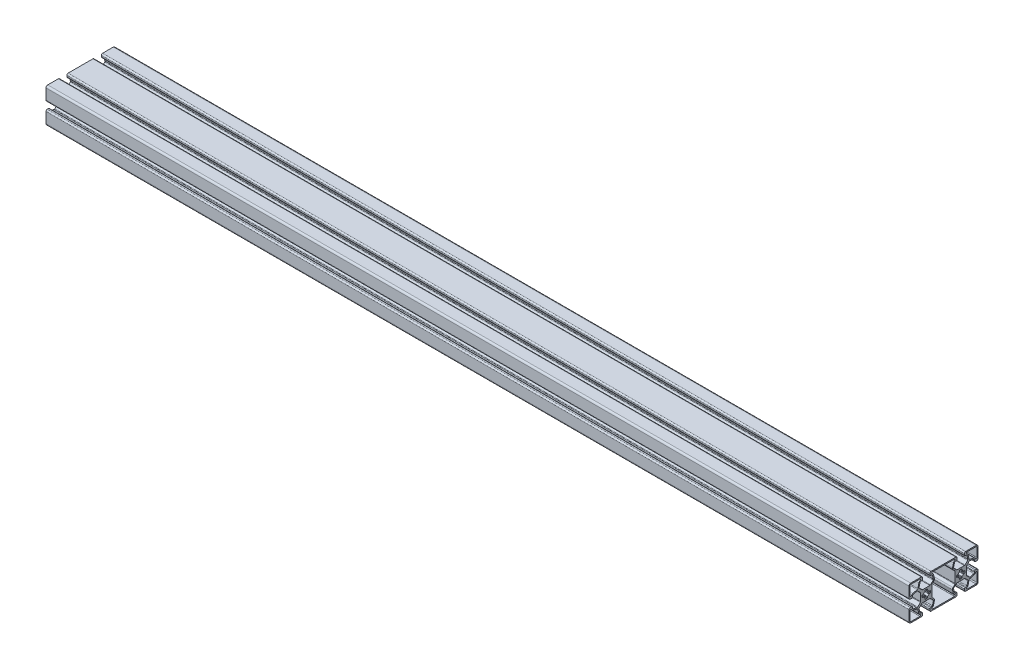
SolidWorks part; units mm, degrees
ref_plane "正面" through (0, 0, 0) normal (0, 0, 1) x (1, 0, 0)
ref_plane "平面" through (0, 0, 0) normal (0, 1, 0) x (1, 0, 0)
ref_plane "右側面" through (0, 0, 0) normal (1, 0, 0) x (0, 0, -1)
sketch "ｽｹｯﾁ1" plane through (0, 0, 0) normal (1, 0, 0) x (0, 0, -1)
  line L0 (34.85, 16) -> (33.7809, 16)
  line L1 (5.65, 20) -> (34.35, 20)
  line L2 (31.9685, 9.87) -> (35.0456, 6.7929)
  line L3 (33.7809, -16) -> (34.85, -16)
  line L4 (35.0456, -6.7929) -> (31.9685, -9.87)
  line L5 (34.35, -20) -> (5.65, -20)
  line L6 (32.8107, 15.2424) -> (31.7054, 10.8195)
  line L7 (8.2946, 10.8195) -> (7.1893, 15.2424)
  line L8 (-7.1893, 15.2424) -> (-8.2946, 10.8195)
  line L9 (-20, 5.65) -> (-20, 18)
  line L10 (4.2473, -6.5) -> (-4.2473, -6.5)
  line L11 (-4.2473, 6.5) -> (4.2473, 6.5)
  line L12 (-8.2946, -10.8195) -> (-7.1893, -15.2424)
  line L13 (-20, -18) -> (-20, -5.65)
  line L14 (-5.65, -20) -> (-18, -20)
  line L15 (-4.15, -17) -> (-4.15, -18.5)
  line L16 (-6.2191, -16) -> (-5.15, -16)
  line L17 (-10.8195, 8.2946) -> (-15.2424, 7.1893)
  line L18 (-15.2424, -7.1893) -> (-10.8195, -8.2946)
  line L19 (-16, -5.15) -> (-16, -6.2191)
  line L20 (-18.5, -4.15) -> (-17, -4.15)
  line L21 (-16, 6.2191) -> (-16, 5.15)
  line L22 (-17, 4.15) -> (-18.5, 4.15)
  line L23 (-4.8, -0.75) -> (-4.8, 0.75)
  line L24 (-6.5, -4.2473) -> (-6.5, 4.2473)
  line L25 (-9.87, -8.0315) -> (-6.7929, -4.9544)
  line L26 (-4.9544, -6.7929) -> (-8.0315, -9.87)
  line L27 (1.25, -3.4853) -> (1.25, -4.3)
  line L28 (-1.25, -3.4853) -> (-1.25, -4.3)
  line L29 (-3.4853, -1.25) -> (-4.3, -1.25)
  line L30 (0.75, -4.8) -> (-0.75, -4.8)
  line L31 (-6.7929, 4.9544) -> (-9.87, 8.0315)
  line L32 (-8.0315, 9.87) -> (-4.9544, 6.7929)
  line L33 (1.25, 3.4853) -> (1.25, 4.3)
  line L34 (-3.4853, 1.25) -> (-4.3, 1.25)
  line L35 (-1.25, 3.4853) -> (-1.25, 4.3)
  line L36 (0.75, 4.8) -> (-0.75, 4.8)
  line L37 (31.7054, -10.8195) -> (32.8107, -15.2424)
  line L38 (7.1893, -15.2424) -> (8.2946, -10.8195)
  line L39 (5.15, -16) -> (6.2191, -16)
  line L40 (4.15, -18.5) -> (4.15, -17)
  line L41 (4.8, -0.75) -> (4.8, 0.75)
  line L42 (6.5, 6.0858) -> (6.5, -6.0858)
  line L43 (3.4853, -1.25) -> (4.3, -1.25)
  line L44 (8.0315, -9.87) -> (4.9544, -6.7929)
  line L45 (4.9544, 6.7929) -> (8.0315, 9.87)
  line L46 (3.4853, 1.25) -> (4.3, 1.25)
  line L47 (33.5, -6.0858) -> (33.5, 6.0858)
  line L48 (-18, 20) -> (-5.65, 20)
  line L49 (-4.15, 18.5) -> (-4.15, 17)
  line L50 (-5.15, 16) -> (-6.2191, 16)
  line L51 (6.2191, 16) -> (5.15, 16)
  line L52 (4.15, 17) -> (4.15, 18.5)
  line L53 (60, 18) -> (60, 5.65)
  line L54 (48.2946, 10.8195) -> (47.1893, 15.2424)
  line L55 (60, -5.65) -> (60, -18)
  line L56 (47.1893, -15.2424) -> (48.2946, -10.8195)
  line L57 (58, -20) -> (45.65, -20)
  line L58 (35.85, -17) -> (35.85, -18.5)
  line L59 (45.15, -16) -> (46.2191, -16)
  line L60 (44.15, -18.5) -> (44.15, -17)
  line L61 (44.8, -0.75) -> (44.8, 0.75)
  line L62 (35.2, -0.75) -> (35.2, 0.75)
  line L63 (46.5, 4.2473) -> (46.5, -4.2473)
  line L64 (44.2473, -6.5) -> (35.7527, -6.5)
  line L65 (40.75, -4.8) -> (39.25, -4.8)
  line L66 (38.75, -3.4853) -> (38.75, -4.3)
  line L67 (41.25, -3.4853) -> (41.25, -4.3)
  line L68 (36.5147, -1.25) -> (35.7, -1.25)
  line L69 (43.4853, -1.25) -> (44.3, -1.25)
  line L70 (48.0315, -9.87) -> (44.9544, -6.7929)
  line L71 (46.7929, -4.9544) -> (49.87, -8.0315)
  line L72 (35.7527, 6.5) -> (44.2473, 6.5)
  line L73 (40.75, 4.8) -> (39.25, 4.8)
  line L74 (36.5147, 1.25) -> (35.7, 1.25)
  line L75 (38.75, 3.4853) -> (38.75, 4.3)
  line L76 (41.25, 3.4853) -> (41.25, 4.3)
  line L77 (44.9544, 6.7929) -> (48.0315, 9.87)
  line L78 (43.4853, 1.25) -> (44.3, 1.25)
  line L79 (49.87, 8.0315) -> (46.7929, 4.9544)
  line L80 (56, -6.2191) -> (56, -5.15)
  line L81 (57, -4.15) -> (58.5, -4.15)
  line L82 (50.8195, -8.2946) -> (55.2424, -7.1893)
  line L83 (56, 5.15) -> (56, 6.2191)
  line L84 (55.2424, 7.1893) -> (50.8195, 8.2946)
  line L85 (58.5, 4.15) -> (57, 4.15)
  line L86 (45.65, 20) -> (58, 20)
  line L87 (35.85, 18.5) -> (35.85, 17)
  line L88 (46.2191, 16) -> (45.15, 16)
  line L89 (44.15, 17) -> (44.15, 18.5)
  line L90 (-18.7, -17.7) -> (-18.7, -7.3146)
  line L91 (-7.3146, -18.7) -> (-17.7, -18.7)
  line L92 (-15.5576, -8.4505) -> (-10.4537, -9.7259)
  line L93 (-9.7259, -10.4537) -> (-8.4505, -15.5576)
  line L94 (8.9507, -8.9507) -> (6.7929, -6.7929)
  line L95 (8.4505, -15.5576) -> (9.5558, -11.1347)
  line L96 (32.6854, -18.7) -> (7.3146, -18.7)
  line L97 (30.4442, -11.1347) -> (31.5495, -15.5576)
  line L98 (33.2071, -6.7929) -> (31.0493, -8.9507)
  line L99 (31.0493, 8.9507) -> (33.2071, 6.7929)
  line L100 (31.5495, 15.5576) -> (30.4442, 11.1347)
  line L101 (7.3146, 18.7) -> (32.6854, 18.7)
  line L102 (9.5558, 11.1347) -> (8.4505, 15.5576)
  line L103 (6.7929, 6.7929) -> (8.9507, 8.9507)
  line L104 (47.3146, -18.7) -> (57.7, -18.7)
  line L105 (49.7259, -10.4537) -> (48.4505, -15.5576)
  line L106 (55.5576, -8.4505) -> (50.4537, -9.7259)
  line L107 (58.7, -17.7) -> (58.7, -7.3146)
  line L108 (47.3146, 18.7) -> (57.7, 18.7)
  line L109 (49.7259, 10.4537) -> (48.4505, 15.5576)
  line L110 (55.5576, 8.4505) -> (50.4537, 9.7259)
  line L111 (58.7, 17.7) -> (58.7, 7.3146)
  line L112 (-18.7, 17.7) -> (-18.7, 7.3146)
  line L113 (-7.3146, 18.7) -> (-17.7, 18.7)
  line L114 (-15.5576, 8.4505) -> (-10.4537, 9.7259)
  line L115 (-9.7259, 10.4537) -> (-8.4505, 15.5576)
  arc A0 (1.25, 4.3) -> (0.75, 4.8) centre (0.75, 4.3) ccw
  arc A1 (0.75, -4.8) -> (1.25, -4.3) centre (0.75, -4.3) ccw
  arc A2 (1.5256, -3.0385) -> (1.25, -3.4853) centre (1.75, -3.4853) ccw
  arc A3 (1.25, 3.4853) -> (1.5256, 3.0385) centre (1.75, 3.4853) ccw
  arc A4 (-20, -18) -> (-18, -20) centre (-18, -18) ccw
  arc A5 (-7.1893, -15.2424) -> (-6.2191, -16) centre (-6.2191, -15) ccw
  arc A6 (-4.15, -17) -> (-5.15, -16) centre (-5.15, -17) ccw
  arc A7 (-5.65, -20) -> (-4.15, -18.5) centre (-5.65, -18.5) ccw
  arc A8 (-18.5, -4.15) -> (-20, -5.65) centre (-18.5, -5.65) ccw
  arc A9 (-16, -5.15) -> (-17, -4.15) centre (-17, -5.15) ccw
  arc A10 (-16, -6.2191) -> (-15.2424, -7.1893) centre (-15, -6.2191) ccw
  arc A11 (-20, 5.65) -> (-18.5, 4.15) centre (-18.5, 5.65) ccw
  arc A12 (-17, 4.15) -> (-16, 5.15) centre (-17, 5.15) ccw
  arc A13 (-15.2424, 7.1893) -> (-16, 6.2191) centre (-15, 6.2191) ccw
  arc A14 (-8.0315, -9.87) -> (-8.2946, -10.8195) centre (-7.3244, -10.5771) ccw
  arc A15 (-10.8195, -8.2946) -> (-9.87, -8.0315) centre (-10.5771, -7.3244) ccw
  arc A16 (-3.0385, -1.5256) -> (-3.4853, -1.25) centre (-3.4853, -1.75) ccw
  arc A17 (-4.8, -0.75) -> (-4.3, -1.25) centre (-4.3, -0.75) ccw
  arc A18 (-3.0385, -1.5256) -> (-1.5256, -3.0385) centre (0, 0) ccw
  arc A19 (-1.25, -3.4853) -> (-1.5256, -3.0385) centre (-1.75, -3.4853) ccw
  arc A20 (-1.25, -4.3) -> (-0.75, -4.8) centre (-0.75, -4.3) ccw
  arc A21 (-6.7929, -4.9544) -> (-6.5, -4.2473) centre (-7.5, -4.2473) ccw
  arc A22 (-4.2473, -6.5) -> (-4.9544, -6.7929) centre (-4.2473, -7.5) ccw
  arc A23 (-8.2946, 10.8195) -> (-8.0315, 9.87) centre (-7.3244, 10.5771) ccw
  arc A24 (-9.87, 8.0315) -> (-10.8195, 8.2946) centre (-10.5771, 7.3244) ccw
  arc A25 (-0.75, 4.8) -> (-1.25, 4.3) centre (-0.75, 4.3) ccw
  arc A26 (-6.5, 4.2473) -> (-6.7929, 4.9544) centre (-7.5, 4.2473) ccw
  arc A27 (-4.9544, 6.7929) -> (-4.2473, 6.5) centre (-4.2473, 7.5) ccw
  arc A28 (-3.4853, 1.25) -> (-3.0385, 1.5256) centre (-3.4853, 1.75) ccw
  arc A29 (-1.5256, 3.0385) -> (-3.0385, 1.5256) centre (0, 0) ccw
  arc A30 (-1.5256, 3.0385) -> (-1.25, 3.4853) centre (-1.75, 3.4853) ccw
  arc A31 (-4.3, 1.25) -> (-4.8, 0.75) centre (-4.3, 0.75) ccw
  arc A32 (5.15, -16) -> (4.15, -17) centre (5.15, -17) ccw
  arc A33 (6.2191, -16) -> (7.1893, -15.2424) centre (6.2191, -15) ccw
  arc A34 (4.15, -18.5) -> (5.65, -20) centre (5.65, -18.5) ccw
  arc A35 (32.8107, -15.2424) -> (33.7809, -16) centre (33.7809, -15) ccw
  arc A36 (4.3, -1.25) -> (4.8, -0.75) centre (4.3, -0.75) ccw
  arc A37 (3.4853, -1.25) -> (3.0385, -1.5256) centre (3.4853, -1.75) ccw
  arc A38 (4.9544, -6.7929) -> (4.2473, -6.5) centre (4.2473, -7.5) ccw
  arc A39 (1.5256, -3.0385) -> (3.0385, -1.5256) centre (0, 0) ccw
  arc A40 (8.2946, -10.8195) -> (8.0315, -9.87) centre (7.3244, -10.5771) ccw
  arc A41 (8.0315, 9.87) -> (8.2946, 10.8195) centre (7.3244, 10.5771) ccw
  arc A42 (4.2473, 6.5) -> (4.9544, 6.7929) centre (4.2473, 7.5) ccw
  arc A43 (4.8, 0.75) -> (4.3, 1.25) centre (4.3, 0.75) ccw
  arc A44 (3.0385, 1.5256) -> (1.5256, 3.0385) centre (0, 0) ccw
  arc A45 (3.0385, 1.5256) -> (3.4853, 1.25) centre (3.4853, 1.75) ccw
  arc A46 (31.9685, -9.87) -> (31.7054, -10.8195) centre (32.6756, -10.5771) ccw
  arc A47 (31.7054, 10.8195) -> (31.9685, 9.87) centre (32.6756, 10.5771) ccw
  arc A48 (-18, 20) -> (-20, 18) centre (-18, 18) ccw
  arc A49 (-6.2191, 16) -> (-7.1893, 15.2424) centre (-6.2191, 15) ccw
  arc A50 (-5.15, 16) -> (-4.15, 17) centre (-5.15, 17) ccw
  arc A51 (-4.15, 18.5) -> (-5.65, 20) centre (-5.65, 18.5) ccw
  arc A52 (5.65, 20) -> (4.15, 18.5) centre (5.65, 18.5) ccw
  arc A53 (4.15, 17) -> (5.15, 16) centre (5.15, 17) ccw
  arc A54 (7.1893, 15.2424) -> (6.2191, 16) centre (6.2191, 15) ccw
  arc A55 (33.7809, 16) -> (32.8107, 15.2424) centre (33.7809, 15) ccw
  arc A56 (35.85, -17) -> (34.85, -16) centre (34.85, -17) ccw
  arc A57 (34.35, -20) -> (35.85, -18.5) centre (34.35, -18.5) ccw
  arc A58 (46.2191, -16) -> (47.1893, -15.2424) centre (46.2191, -15) ccw
  arc A59 (45.15, -16) -> (44.15, -17) centre (45.15, -17) ccw
  arc A60 (44.15, -18.5) -> (45.65, -20) centre (45.65, -18.5) ccw
  arc A61 (58, -20) -> (60, -18) centre (58, -18) ccw
  arc A62 (50.8195, 8.2946) -> (49.87, 8.0315) centre (50.5771, 7.3244) ccw
  arc A63 (49.87, -8.0315) -> (50.8195, -8.2946) centre (50.5771, -7.3244) ccw
  arc A64 (41.5256, -3.0385) -> (43.0385, -1.5256) centre (40, 0) ccw
  arc A65 (36.9615, -1.5256) -> (36.5147, -1.25) centre (36.5147, -1.75) ccw
  arc A66 (35.2, -0.75) -> (35.7, -1.25) centre (35.7, -0.75) ccw
  arc A67 (40.75, -4.8) -> (41.25, -4.3) centre (40.75, -4.3) ccw
  arc A68 (36.9615, -1.5256) -> (38.4744, -3.0385) centre (40, 0) ccw
  arc A69 (38.75, -3.4853) -> (38.4744, -3.0385) centre (38.25, -3.4853) ccw
  arc A70 (38.75, -4.3) -> (39.25, -4.8) centre (39.25, -4.3) ccw
  arc A71 (35.7527, -6.5) -> (35.0456, -6.7929) centre (35.7527, -7.5) ccw
  arc A72 (41.5256, -3.0385) -> (41.25, -3.4853) centre (41.75, -3.4853) ccw
  arc A73 (44.3, -1.25) -> (44.8, -0.75) centre (44.3, -0.75) ccw
  arc A74 (43.4853, -1.25) -> (43.0385, -1.5256) centre (43.4853, -1.75) ccw
  arc A75 (46.5, -4.2473) -> (46.7929, -4.9544) centre (47.5, -4.2473) ccw
  arc A76 (44.9544, -6.7929) -> (44.2473, -6.5) centre (44.2473, -7.5) ccw
  arc A77 (48.2946, -10.8195) -> (48.0315, -9.87) centre (47.3244, -10.5771) ccw
  arc A78 (43.0385, 1.5256) -> (41.5256, 3.0385) centre (40, 0) ccw
  arc A79 (41.25, 4.3) -> (40.75, 4.8) centre (40.75, 4.3) ccw
  arc A80 (39.25, 4.8) -> (38.75, 4.3) centre (39.25, 4.3) ccw
  arc A81 (35.0456, 6.7929) -> (35.7527, 6.5) centre (35.7527, 7.5) ccw
  arc A82 (38.4744, 3.0385) -> (36.9615, 1.5256) centre (40, 0) ccw
  arc A83 (38.4744, 3.0385) -> (38.75, 3.4853) centre (38.25, 3.4853) ccw
  arc A84 (35.7, 1.25) -> (35.2, 0.75) centre (35.7, 0.75) ccw
  arc A85 (36.5147, 1.25) -> (36.9615, 1.5256) centre (36.5147, 1.75) ccw
  arc A86 (41.25, 3.4853) -> (41.5256, 3.0385) centre (41.75, 3.4853) ccw
  arc A87 (48.0315, 9.87) -> (48.2946, 10.8195) centre (47.3244, 10.5771) ccw
  arc A88 (46.7929, 4.9544) -> (46.5, 4.2473) centre (47.5, 4.2473) ccw
  arc A89 (44.2473, 6.5) -> (44.9544, 6.7929) centre (44.2473, 7.5) ccw
  arc A90 (43.0385, 1.5256) -> (43.4853, 1.25) centre (43.4853, 1.75) ccw
  arc A91 (44.8, 0.75) -> (44.3, 1.25) centre (44.3, 0.75) ccw
  arc A92 (60, -5.65) -> (58.5, -4.15) centre (58.5, -5.65) ccw
  arc A93 (57, -4.15) -> (56, -5.15) centre (57, -5.15) ccw
  arc A94 (55.2424, -7.1893) -> (56, -6.2191) centre (55, -6.2191) ccw
  arc A95 (58.5, 4.15) -> (60, 5.65) centre (58.5, 5.65) ccw
  arc A96 (56, 6.2191) -> (55.2424, 7.1893) centre (55, 6.2191) ccw
  arc A97 (56, 5.15) -> (57, 4.15) centre (57, 5.15) ccw
  arc A98 (34.85, 16) -> (35.85, 17) centre (34.85, 17) ccw
  arc A99 (35.85, 18.5) -> (34.35, 20) centre (34.35, 18.5) ccw
  arc A100 (45.65, 20) -> (44.15, 18.5) centre (45.65, 18.5) ccw
  arc A101 (44.15, 17) -> (45.15, 16) centre (45.15, 17) ccw
  arc A102 (47.1893, 15.2424) -> (46.2191, 16) centre (46.2191, 15) ccw
  arc A103 (60, 18) -> (58, 20) centre (58, 18) ccw
  arc A104 (-18.7, -17.7) -> (-17.7, -18.7) centre (-17.7, -17.7) ccw
  arc A105 (-17.1516, -7.0319) -> (-15.5576, -8.4505) centre (-15, -6.2191) ccw
  arc A106 (-8.4505, -15.5576) -> (-7.0319, -17.1516) centre (-6.2191, -15) ccw
  arc A107 (-7.3146, -18.7) -> (-7.0319, -17.1516) centre (-7.3146, -17.9) ccw
  arc A108 (-9.7259, -10.4537) -> (-10.4537, -9.7259) centre (-10.6961, -10.6961) ccw
  arc A109 (-17.1516, -7.0319) -> (-18.7, -7.3146) centre (-17.9, -7.3146) ccw
  arc A110 (9.5558, -11.1347) -> (8.9507, -8.9507) centre (7.3244, -10.5771) ccw
  arc A111 (7.0319, -17.1516) -> (8.4505, -15.5576) centre (6.2191, -15) ccw
  arc A112 (7.0319, -17.1516) -> (7.3146, -18.7) centre (7.3146, -17.9) ccw
  arc A113 (6.5, -6.0858) -> (6.7929, -6.7929) centre (7.5, -6.0858) ccw
  arc A114 (31.5495, -15.5576) -> (32.9681, -17.1516) centre (33.7809, -15) ccw
  arc A115 (31.0493, -8.9507) -> (30.4442, -11.1347) centre (32.6756, -10.5771) ccw
  arc A116 (30.4442, 11.1347) -> (31.0493, 8.9507) centre (32.6756, 10.5771) ccw
  arc A117 (32.9681, 17.1516) -> (31.5495, 15.5576) centre (33.7809, 15) ccw
  arc A118 (33.5, 6.0858) -> (33.2071, 6.7929) centre (32.5, 6.0858) ccw
  arc A119 (33.2071, -6.7929) -> (33.5, -6.0858) centre (32.5, -6.0858) ccw
  arc A120 (8.9507, 8.9507) -> (9.5558, 11.1347) centre (7.3244, 10.5771) ccw
  arc A121 (6.7929, 6.7929) -> (6.5, 6.0858) centre (7.5, 6.0858) ccw
  arc A122 (8.4505, 15.5576) -> (7.0319, 17.1516) centre (6.2191, 15) ccw
  arc A123 (7.3146, 18.7) -> (7.0319, 17.1516) centre (7.3146, 17.9) ccw
  arc A124 (32.9681, 17.1516) -> (32.6854, 18.7) centre (32.6854, 17.9) ccw
  arc A125 (32.6854, -18.7) -> (32.9681, -17.1516) centre (32.6854, -17.9) ccw
  arc A126 (47.0319, -17.1516) -> (47.3146, -18.7) centre (47.3146, -17.9) ccw
  arc A127 (47.0319, -17.1516) -> (48.4505, -15.5576) centre (46.2191, -15) ccw
  arc A128 (50.4537, -9.7259) -> (49.7259, -10.4537) centre (50.6961, -10.6961) ccw
  arc A129 (55.5576, -8.4505) -> (57.1516, -7.0319) centre (55, -6.2191) ccw
  arc A130 (57.7, -18.7) -> (58.7, -17.7) centre (57.7, -17.7) ccw
  arc A131 (58.7, -7.3146) -> (57.1516, -7.0319) centre (57.9, -7.3146) ccw
  arc A132 (47.3146, 18.7) -> (47.0319, 17.1516) centre (47.3146, 17.9) ccw
  arc A133 (48.4505, 15.5576) -> (47.0319, 17.1516) centre (46.2191, 15) ccw
  arc A134 (58.7, 17.7) -> (57.7, 18.7) centre (57.7, 17.7) ccw
  arc A135 (49.7259, 10.4537) -> (50.4537, 9.7259) centre (50.6961, 10.6961) ccw
  arc A136 (57.1516, 7.0319) -> (58.7, 7.3146) centre (57.9, 7.3146) ccw
  arc A137 (57.1516, 7.0319) -> (55.5576, 8.4505) centre (55, 6.2191) ccw
  arc A138 (-17.7, 18.7) -> (-18.7, 17.7) centre (-17.7, 17.7) ccw
  arc A139 (-15.5576, 8.4505) -> (-17.1516, 7.0319) centre (-15, 6.2191) ccw
  arc A140 (-7.0319, 17.1516) -> (-8.4505, 15.5576) centre (-6.2191, 15) ccw
  arc A141 (-7.0319, 17.1516) -> (-7.3146, 18.7) centre (-7.3146, 17.9) ccw
  arc A142 (-10.4537, 9.7259) -> (-9.7259, 10.4537) centre (-10.6961, 10.6961) ccw
  arc A143 (-18.7, 7.3146) -> (-17.1516, 7.0319) centre (-17.9, 7.3146) ccw
extrude "ﾎﾞｽ - 押し出し1" add sketch "ｽｹｯﾁ1" along normal blind 1000
